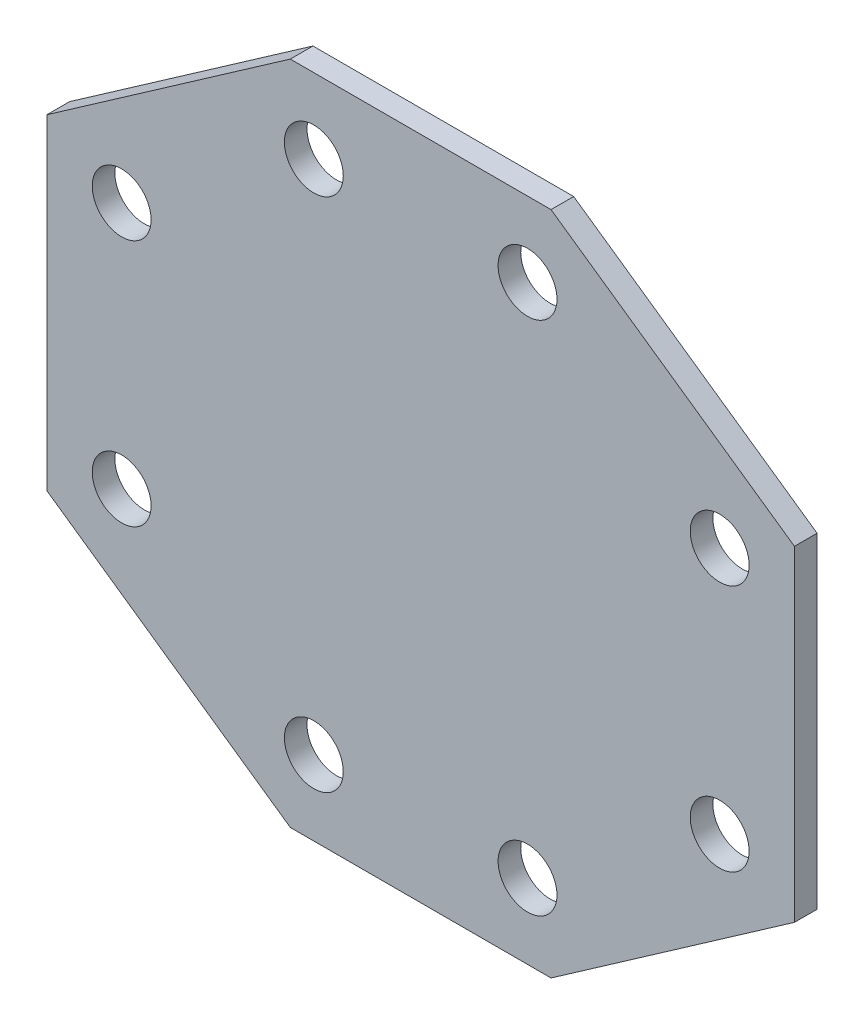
SolidWorks part; units mm, degrees
ref_plane "Front Plane" through (0, 0, 0) normal (1, 0, 0) x (0, 1, 0)
ref_plane "Top Plane" through (0, 0, 0) normal (0, 0, 1) x (0, 1, 0)
ref_plane "Right Plane" through (0, 0, 0) normal (0, 1, 0) x (-1, 0, 0)
sketch "sk W14x730" plane through (0, 0, 0) normal (0, 0, 1) x (0, 1, 0)
  point P0 (0, -284.734)
  point P1 (-38.989, 0)
  line B0 (-227.203, -284.734) -> (-227.203, -160.02)
  line B1 (-227.203, -160.02) -> (-54.229, -160.02)
  line B2 (-38.989, -144.78) -> (-38.989, 144.78)
  line B3 (-54.229, 160.02) -> (-227.203, 160.02)
  line B4 (-227.203, 160.02) -> (-227.203, 284.734)
  line B5 (-227.203, 284.734) -> (227.203, 284.734)
  line B6 (227.203, 284.734) -> (227.203, 160.02)
  line B7 (227.203, 160.02) -> (54.229, 160.02)
  line B8 (38.989, 144.78) -> (38.989, -144.78)
  line B9 (54.229, -160.02) -> (227.203, -160.02)
  line B10 (227.203, -160.02) -> (227.203, -284.734)
  line B11 (227.203, -284.734) -> (-227.203, -284.734)
  arc B12 (-54.229, -160.02) -> (-38.989, -144.78) centre (-54.229, -144.78) ccw
  arc B13 (-38.989, 144.78) -> (-54.229, 160.02) centre (-54.229, 144.78) ccw
  arc B14 (54.229, 160.02) -> (38.989, 144.78) centre (54.229, 144.78) ccw
  arc B15 (38.989, -144.78) -> (54.229, -160.02) centre (54.229, -144.78) ccw
sketch_block_instance "W14x730-113"
sketch_block "W14x730" parameters "D4"=15.24, "D1"=454.406, "D2"=569.468, "D3"=77.978, "D5"=124.714
sketch_block_instance "W14x730-232"
sketch_block_instance "W14x730-233"
sketch_block_instance "W14x730-234"
sketch_block_instance "W14x730-276"
sketch_block_instance "W14x730-277"
sketch_block_instance "W14x730-278"
sketch_block_instance "W14x730-279"
sketch_block_instance "W14x730-280"
sketch_block_instance "W14x730-281"
sketch_block_instance "W14x730-282"
sketch_block_instance "W14x730-283"
sketch_block_instance "W14x730-284"
sketch_block_instance "W14x730-285"
sketch_block_instance "W14x730-286"
sketch_block_instance "W14x730-287"
sketch_block_instance "W14x730-288"
sketch_block_instance "W14x730-289"
sketch_block_instance "W14x730-321"
sketch_block_instance "W14x730-322"
sketch_block_instance "W14x730-323"
sketch_block_instance "W14x730-324"
sketch_block_instance "W14x730-325"
sketch_block_instance "W14x730-326"
sketch_block_instance "W14x730-327"
sketch_block_instance "W14x730-328"
sketch_block_instance "W14x730-329"
sketch_block_instance "W14x730-330"
sketch_block_instance "W14x730-331"
sketch_block_instance "W14x730-332"
sketch_block_instance "W14x730-333"
sketch_block_instance "W14x730-334"
sketch_block_instance "W14x730-335"
sketch_block_instance "W14x730-336"
sketch_block_instance "W14x730-337"
sketch_block_instance "W14x730-338"
sketch_block_instance "W14x730-339"
sketch_block_instance "W14x730-340"
sketch_block_instance "W14x730-341"
sketch_block_instance "W14x730-365"
sketch_block_instance "W14x730-366"
sketch_block_instance "W14x730-367"
sketch_block_instance "W14x730-368"
sketch_block_instance "W14x730-369"
sketch_block_instance "W14x730-370"
sketch_block_instance "W14x730-371"
sketch_block_instance "W14x730-372"
sketch_block_instance "W14x730-373"
sketch_block_instance "W14x730-374"
sketch_block_instance "W14x730-375"
sketch_block_instance "W14x730-376"
sketch_block_instance "W14x730-377"
sketch_block_instance "W14x730-378"
sketch_block_instance "W14x730-379"
sketch_block_instance "W14x730-380"
sketch_block_instance "W14x730-381"
sketch_block_instance "W14x730-382"
sketch_block_instance "W14x730-383"
sketch_block_instance "W14x730-384"
sketch_block_instance "W14x730-385"
sketch_block_instance "W14x730-386"
sketch_block_instance "W14x730-387"
sketch_block_instance "W14x730-388"
sketch_block_instance "W14x730-389"
sketch_block_instance "W14x730-390"
sketch_block_instance "W14x730-391"
sketch_block_instance "W14x730-410"
sketch_block_instance "W14x730-411"
sketch_block_instance "W14x730-412"
sketch_block_instance "W14x730-413"
sketch_block_instance "W14x730-414"
sketch_block_instance "W14x730-415"
sketch_block_instance "W14x730-416"
sketch_block_instance "W14x730-417"
sketch_block_instance "W14x730-418"
sketch_block_instance "W14x730-419"
sketch_block_instance "W14x730-420"
sketch_block_instance "W14x730-421"
sketch_block_instance "W14x730-422"
sketch_block_instance "W14x730-423"
sketch_block_instance "W14x730-424"
sketch_block_instance "W14x730-425"
sketch_block_instance "W14x730-426"
sketch_block_instance "W14x730-427"
sketch_block_instance "W14x730-428"
sketch_block_instance "W14x730-429"
sketch_block_instance "W14x730-430"
sketch_block_instance "W14x730-431"
sketch_block_instance "W14x730-432"
sketch_block_instance "W14x730-433"
sketch_block_instance "W14x730-434"
sketch_block_instance "W14x730-435"
sketch_block_instance "W14x730-436"
sketch_block_instance "W14x730-437"
sketch_block_instance "W14x730-438"
sketch_block_instance "W14x730-439"
sketch_block_instance "W14x730-440"
sketch_block_instance "W14x730-443"
sketch_block_instance "W14x730-454"
sketch_block_instance "W14x730-455"
sketch_block_instance "W14x730-456"
sketch_block_instance "W14x730-457"
sketch_block_instance "W14x730-458"
sketch_block_instance "W14x730-459"
sketch_block_instance "W14x730-460"
sketch_block_instance "W14x730-461"
sketch_block_instance "W14x730-462"
sketch_block_instance "W14x730-463"
sketch_block_instance "W14x730-464"
sketch_block_instance "W14x730-465"
sketch_block_instance "W14x730-466"
sketch_block_instance "W14x730-467"
sketch_block_instance "W14x730-468"
sketch_block_instance "W14x730-469"
sketch_block_instance "W14x730-470"
sketch_block_instance "W14x730-471"
sketch_block_instance "W14x730-472"
sketch_block_instance "W14x730-473"
sketch_block_instance "W14x730-474"
sketch_block_instance "W14x730-475"
sketch_block_instance "W14x730-476"
sketch_block_instance "W14x730-477"
sketch_block_instance "W14x730-478"
sketch_block_instance "W14x730-479"
sketch_block_instance "W14x730-480"
sketch_block_instance "W14x730-481"
sketch_block_instance "W14x730-482"
sketch_block_instance "W14x730-483"
sketch_block_instance "W14x730-484"
sketch_block_instance "W14x730-485"
sketch_block_instance "W14x730-486"
sketch_block_instance "W14x730-487"
sketch_block_instance "W14x730-488"
sketch_block_instance "W14x730-489"
sketch_block_instance "W14x730-490" parameters "D1"=817.9177, "D2"=1027.7361, "D3"=0.4058, "D4"=24.0009, "D5"=0.4058, "D6"=533.4, "D7"=27.3509, "D8"=8374.3758, "D9"=3499.6788, "D10"=18059.4
sketch "sk 4\" hex nut Pattern" plane through (0, 0, 0) normal (0, 0, 1) x (0, 1, 0)
  line L7 (419.0803, -173.5887) -> (419.0803, 173.5887)
  line L8 (419.0803, 173.5887) -> (173.5887, 419.0803)
  line L9 (173.5887, 419.0803) -> (-173.5887, 419.0803)
  line L10 (-173.5887, 419.0803) -> (-419.0803, 173.5887)
  line L11 (-419.0803, 173.5887) -> (-419.0803, -173.5887)
  line L12 (-419.0803, -173.5887) -> (-173.5887, -419.0803)
  line L13 (-173.5887, -419.0803) -> (173.5887, -419.0803)
  line L14 (173.5887, -419.0803) -> (419.0803, -173.5887)
  line L29 (54.229, -125.02) -> (262.203, -125.02)
  line L30 (262.203, -125.02) -> (262.203, -319.734)
  line L31 (-262.203, -125.02) -> (-54.229, -125.02)
  line L32 (-262.203, -319.734) -> (-262.203, -125.02)
  line L33 (262.203, -319.734) -> (-262.203, -319.734)
  line L34 (54.229, -125.02) -> (262.203, -125.02)
  line L35 (262.203, -125.02) -> (262.203, -319.734)
  line L36 (-262.203, -125.02) -> (-54.229, -125.02)
  line L37 (-262.203, -319.734) -> (-262.203, -125.02)
  line L38 (262.203, -319.734) -> (-262.203, -319.734)
  line L39 (-419.0803, 173.5887) -> (419.0803, -173.5887)
  line L40 (419.0803, 173.5887) -> (-419.0803, -173.5887)
  line L42 (-466.3243, 523.8553) -> (466.3243, 523.8553)
  line L43 (-466.3243, 523.8553) -> (-466.3243, -523.8553)
  line L44 (262.203, 125.02) -> (54.229, 125.02)
  line L45 (262.203, 319.734) -> (262.203, 125.02)
  line L46 (-262.203, 319.734) -> (262.203, 319.734)
  line L47 (-262.203, 125.02) -> (-262.203, 319.734)
  line L48 (-54.229, 125.02) -> (-262.203, 125.02)
  line L49 (262.203, 125.02) -> (54.229, 125.02)
  line L50 (262.203, 319.734) -> (262.203, 125.02)
  line L51 (-262.203, 319.734) -> (262.203, 319.734)
  line L52 (-262.203, 125.02) -> (-262.203, 319.734)
  line L53 (-54.229, 125.02) -> (-262.203, 125.02)
  line L54 (-466.3243, -523.8553) -> (466.3243, -523.8553)
  line L55 (466.3243, 523.8553) -> (466.3243, -523.8553)
  circle A0 centre (0, 0) radius 419.0803 construction
  line B0 (-128.6781, -496.8678) -> (-83.7675, -419.0803)
  circle B1 centre (-173.5887, -419.0803) radius 77.7875 construction
  circle B2 centre (-173.5887, -419.0803) radius 50.8
  circle B3 centre (-173.5887, -419.0803) radius 89.8213
  circle B4 centre (-173.5887, -419.0803) radius 99.3463
  line B5 (-83.7675, 419.0803) -> (-128.6781, 496.8678)
  line B6 (-128.6781, 496.8678) -> (-218.4994, 496.8678)
  line B7 (-218.4994, 496.8678) -> (-263.41, 419.0803)
  line B8 (-263.41, 419.0803) -> (-218.4994, 341.2928)
  line B9 (-218.4994, 341.2928) -> (-128.6781, 341.2928)
  circle B10 centre (-173.5887, 419.0803) radius 77.7875 construction
  circle B11 centre (-173.5887, 419.0803) radius 50.8
  circle B12 centre (-173.5887, 419.0803) radius 89.8213
  circle B13 centre (-173.5887, 419.0803) radius 99.3463
  line B14 (263.41, 419.0803) -> (218.4994, 496.8678)
  line B15 (218.4994, 496.8678) -> (128.6781, 496.8678)
  line B16 (128.6781, 496.8678) -> (83.7675, 419.0803)
  line B17 (128.6781, 341.2928) -> (218.4994, 341.2928)
  line B18 (218.4994, 341.2928) -> (263.41, 419.0803)
  circle B19 centre (173.5887, 419.0803) radius 50.8
  circle B20 centre (173.5887, 419.0803) radius 89.8213
  circle B21 centre (173.5887, 419.0803) radius 99.3463
  line B22 (263.41, -419.0803) -> (218.4994, -341.2928)
  line B23 (218.4994, -341.2928) -> (128.6781, -341.2928)
  line B24 (83.7675, -419.0803) -> (128.6781, -496.8678)
  line B25 (128.6781, -496.8678) -> (218.4994, -496.8678)
  line B26 (218.4994, -496.8678) -> (263.41, -419.0803)
  circle B27 centre (173.5887, -419.0803) radius 77.7875 construction
  circle B28 centre (173.5887, -419.0803) radius 50.8
  circle B29 centre (173.5887, -419.0803) radius 89.8213
  circle B30 centre (173.5887, -419.0803) radius 99.3463
  line B31 (-271.728, 149.7586) -> (-316.6386, 227.5461)
  line B32 (-316.6386, 227.5461) -> (-406.4599, 227.5461)
  line B33 (-406.4599, 227.5461) -> (-451.3705, 149.7586)
  line B34 (-451.3705, 149.7586) -> (-406.4599, 71.9711)
  line B35 (-406.4599, 71.9711) -> (-316.6386, 71.9711)
  circle B36 centre (-361.5493, 149.7586) radius 77.7875 construction
  circle B37 centre (-361.5493, 149.7586) radius 50.8
  circle B38 centre (-361.5493, 149.7586) radius 89.8213
  circle B39 centre (-361.5493, 149.7586) radius 99.3463
  line B40 (-271.728, -149.7586) -> (-316.6386, -71.9711)
  line B41 (-316.6386, -71.9711) -> (-406.4599, -71.9711)
  line B42 (-406.4599, -71.9711) -> (-451.3705, -149.7586)
  line B43 (-451.3705, -149.7586) -> (-406.4599, -227.5461)
  line B44 (-406.4599, -227.5461) -> (-316.6386, -227.5461)
  line B45 (-316.6386, -227.5461) -> (-271.728, -149.7586)
  circle B46 centre (-361.5493, -149.7586) radius 77.7875 construction
  circle B47 centre (-361.5493, -149.7586) radius 50.8
  circle B48 centre (-361.5493, -149.7586) radius 89.8213
  circle B49 centre (-361.5493, -149.7586) radius 99.3463
  line B50 (451.3705, 149.7586) -> (406.4599, 227.5461)
  line B51 (406.4599, 227.5461) -> (316.6386, 227.5461)
  line B52 (316.6386, 227.5461) -> (271.728, 149.7586)
  line B53 (316.6386, 71.9711) -> (406.4599, 71.9711)
  circle B54 centre (361.5493, 149.7586) radius 77.7875 construction
  circle B55 centre (361.5493, 149.7586) radius 50.8
  circle B56 centre (361.5493, 149.7586) radius 89.8213
  circle B57 centre (361.5493, 149.7586) radius 99.3463
  line B58 (316.6386, -71.9711) -> (271.728, -149.7586)
  line B59 (406.4599, -227.5461) -> (451.3705, -149.7586)
  circle B60 centre (361.5493, -149.7586) radius 77.7875 construction
  circle B61 centre (361.5493, -149.7586) radius 50.8
  circle B62 centre (361.5493, -149.7586) radius 89.8213
  circle B63 centre (361.5493, -149.7586) radius 99.3463
sketch_block_instance "4\" hex nut-1"
sketch_block "4\" hex nut" parameters "D1"=155.575, "D2"=101.6, "D3"=9.525
sketch_block_instance "4\" hex nut-2"
sketch_block_instance "4\" hex nut-3"
sketch_block_instance "4\" hex nut-4"
sketch_block_instance "4\" hex nut-5"
sketch_block_instance "4\" hex nut-6"
sketch_block_instance "4\" hex nut-7"
sketch_block_instance "4\" hex nut-8" parameters "D1"=129.9071, "D2"=77.383, "D3"=138.8929, "D4"=187.7059, "D5"=195.0068, "D6"=231.3326
sketch "Sketch3" plane through (0, 0, 0) normal (0, 0, 1) x (0, 1, 0)
  line L0 (-466.3243, 523.8553) -> (466.3243, 523.8553) construction
  line L1 (466.3243, 523.8553) -> (466.3243, -523.8553) construction
  line L2 (-466.3243, -523.8553) -> (466.3243, -523.8553) construction
  line L3 (-466.3243, 523.8553) -> (-466.3243, -523.8553) construction
  line L4 (228.2342, 523.8553) -> (466.3243, 182.7049)
  line L5 (466.3243, 182.7049) -> (466.3243, -182.7049)
  line L6 (466.3243, -182.7049) -> (228.2342, -523.8553)
  line L7 (228.2342, -523.8553) -> (-228.2342, -523.8553)
  line L8 (-228.2342, -523.8553) -> (-466.3243, -182.7049)
  line L9 (-466.3243, -182.7049) -> (-466.3243, 182.7049)
  line L10 (-466.3243, 182.7049) -> (-228.2342, 523.8553)
  line L11 (-228.2342, 523.8553) -> (228.2342, 523.8553)
  line L93 (-54.229, 156.845) -> (-230.378, 156.845)
  line L94 (-230.378, 156.845) -> (-230.378, 287.909)
  line L95 (230.378, 156.845) -> (54.229, 156.845)
  line L96 (230.378, 287.909) -> (230.378, 156.845)
  line L97 (-230.378, 287.909) -> (230.378, 287.909)
  line L98 (-54.229, 156.845) -> (-230.378, 156.845) construction
  line L99 (-230.378, 156.845) -> (-230.378, 287.909) construction
  line L100 (230.378, 156.845) -> (54.229, 156.845) construction
  line L101 (230.378, 287.909) -> (230.378, 156.845) construction
  line L102 (-230.378, 287.909) -> (230.378, 287.909) construction
  line L118 (54.229, -156.845) -> (230.378, -156.845)
  line L119 (230.378, -156.845) -> (230.378, -287.909)
  line L120 (230.378, -287.909) -> (-230.378, -287.909)
  line L121 (-230.378, -287.909) -> (-230.378, -156.845)
  line L122 (-230.378, -156.845) -> (-54.229, -156.845)
  line L123 (54.229, -156.845) -> (230.378, -156.845) construction
  line L124 (230.378, -156.845) -> (230.378, -287.909) construction
  line L125 (230.378, -287.909) -> (-230.378, -287.909) construction
  line L126 (-230.378, -287.909) -> (-230.378, -156.845) construction
  line L127 (-230.378, -156.845) -> (-54.229, -156.845) construction
  line L130 (42.164, 144.78) -> (42.164, -144.78)
  line L131 (42.164, 144.78) -> (42.164, -144.78) construction
  line L132 (-54.229, 156.845) -> (-42.164, 144.78) construction
  line L133 (-42.164, -144.78) -> (-42.164, 144.78)
  line L134 (-42.164, -144.78) -> (-42.164, 144.78) construction
  line L135 (42.164, 144.78) -> (54.229, 156.845) construction
  line L136 (42.164, -144.78) -> (54.229, -156.845) construction
  line L137 (-54.229, -156.845) -> (-42.164, -144.78) construction
  circle A0 centre (173.5887, 419.0803) radius 104.775 construction
  circle A1 centre (-173.5887, 419.0803) radius 104.775 construction
  circle A2 centre (-361.5493, 149.7586) radius 104.775 construction
  circle A3 centre (-361.5493, -149.7586) radius 104.775 construction
  circle A4 centre (-173.5887, -419.0803) radius 104.775 construction
  circle A5 centre (173.5887, -419.0803) radius 104.775 construction
  circle A6 centre (361.5493, -149.7586) radius 104.775 construction
  circle A7 centre (361.5493, 149.7586) radius 104.775 construction
  dimension "D1" = 3.175
  dimension "D2" = 3.175
  dimension "D3" = 3.175
  dimension "D4" = 3.175
extrude "Main Plate" add sketch "Sketch3" along normal blind 31.75
sketch "Sketch5" plane through (0, 0, 0) normal (0, 0, 1) x (0, 1, 0)
  circle A0 centre (-173.5887, 419.0803) radius 41.275
  circle A1 centre (173.5887, 419.0803) radius 41.275
  circle A2 centre (361.5493, 149.7586) radius 41.275
  circle A3 centre (361.5493, -149.7586) radius 41.275
  circle A4 centre (173.5887, -419.0803) radius 41.275
  circle A5 centre (-173.5887, -419.0803) radius 41.275
  circle A6 centre (-361.5493, -149.7586) radius 41.275
  circle A7 centre (-361.5493, 149.7586) radius 41.275
  dimension "D1" = 82.55
  dimension "D2" = 82.55
  dimension "D3" = 82.55
  dimension "D4" = 82.55
  dimension "D5" = 82.55
  dimension "D6" = 82.55
  dimension "D7" = 82.55
  dimension "D8" = 82.55
extrude "Cut-Extrude1" cut sketch "Sketch5" against normal through all both and the other way through all
